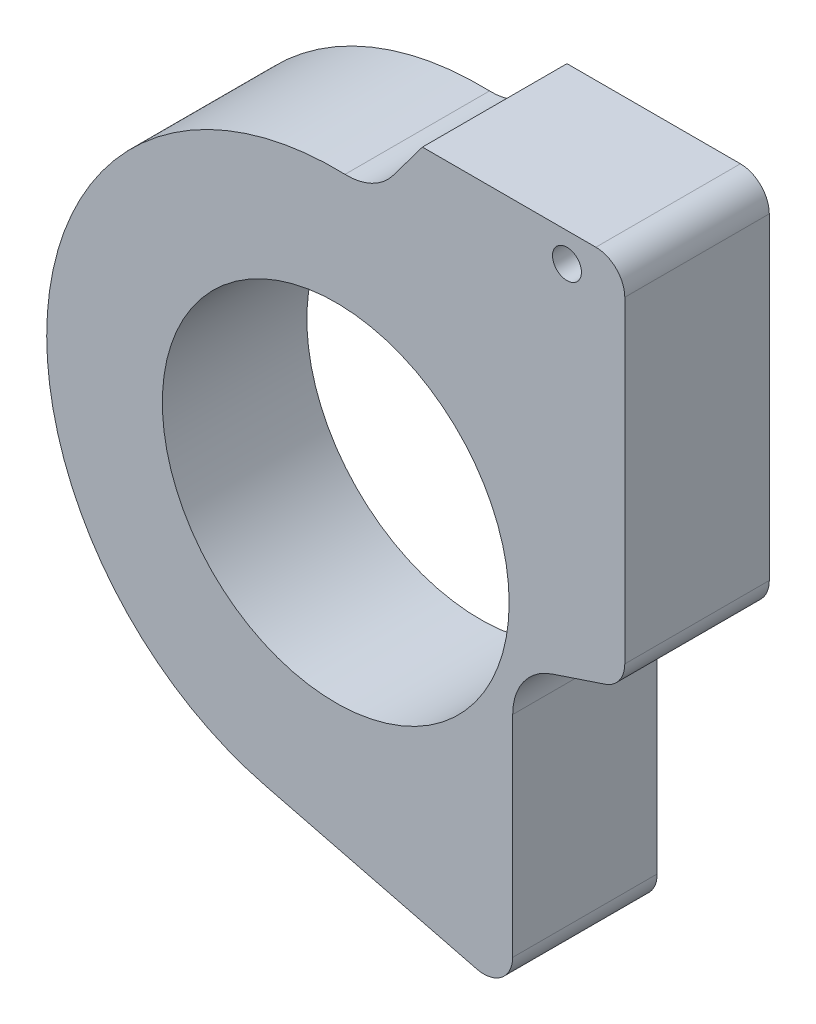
SolidWorks part; units mm, degrees
ref_plane "Plan1" through (0, 0, 0) normal (0, 0, 1) x (1, 0, 0)
ref_plane "Plan2" through (0, 0, 0) normal (0, 1, 0) x (1, 0, 0)
ref_plane "Plan3" through (0, 0, 0) normal (1, 0, 0) x (0, 0, -1)
sketch "Esquisse1" plane through (0, 0, 0) normal (0, 0, 1) x (1, 0, 0)
  line L0 (-2.4363, -9.6987) -> (4.8782, -11.5361)
  line L1 (6.1218, -3.2898) -> (6.1218, -10.5662)
  line L3 (10, 0.1657) -> (10, 11.1515)
  line L4 (9, 12.1515) -> (3, 12.1515)
  line L5 (3, 12.1515) -> (1.9875, 10.7966)
  line L6 (7.4889, -1.3926) -> (9.3165, -0.7829)
  arc A0 (0.3212, 9.9948) -> (-2.4363, -9.6987) centre (0, 0) ccw
  circle A1 centre (0, 0) radius 6
  arc A2 (4.8782, -11.5361) -> (6.1218, -10.5662) centre (5.1218, -10.5662) ccw
  arc A3 (6.1218, -3.2898) -> (7.4889, -1.3926) centre (8.1218, -3.2898) cw
  arc A4 (1.9875, 10.7966) -> (0.3212, 9.9948) centre (0.3854, 11.9938) cw
  arc A5 (10, 0.1657) -> (9.3165, -0.7829) centre (9, 0.1657) cw
  arc A6 (10, 11.1515) -> (9, 12.1515) centre (9, 11.1515) ccw
  circle A7 centre (8, 11.1515) radius 0.5
  point P13 (6.1218, -11.8485)
  dimension "D1" = 20
  dimension "D2" = 10
  dimension "D3" = 12
  dimension "D6" = 1
  dimension "D7" = 2
  dimension "D4" = 2
  dimension "D8" = 1
  dimension "D12" = 1
  dimension "D5" = 24
  dimension "D9" = 3.8782
  dimension "D10" = 6
  dimension "D11" = 2
extrude "Base-Extrusion" add sketch "Esquisse1" against normal blind 5
